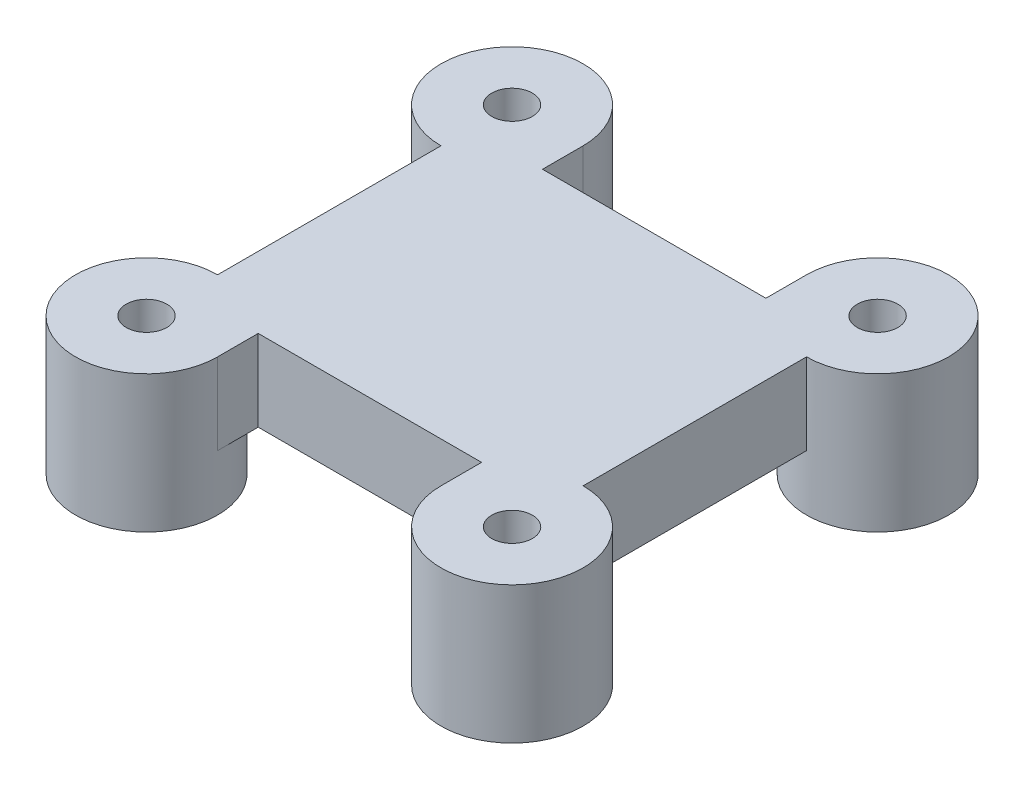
SolidWorks part; units mm, degrees
ref_plane "Front Plane" through (0, 0, 0) normal (0, 0, 1) x (1, 0, 0)
ref_plane "Top Plane" through (0, 0, 0) normal (0, 1, 0) x (1, 0, 0)
ref_plane "Right Plane" through (0, 0, 0) normal (1, 0, 0) x (0, 0, -1)
sketch "Sketch1" plane through (0, 0, 0) normal (0, 1, 0) x (1, 0, 0)
  line L1 (-11, -14) -> (11, -14)
  line L2 (-11, -14) -> (-11, 14)
  line L3 (-11, 14) -> (11, 14)
  line L4 (11, -14) -> (11, 14)
  line L5 (-11, -14) -> (11, 14) construction
  line L6 (-11, 14) -> (11, -14) construction
  line L7 (-11, 18) -> (-18, 18)
  line L8 (-11, 18) -> (-11, -18)
  line L9 (-11, -18) -> (-18, -18)
  line L10 (-18, 18) -> (-18, -18)
  line L11 (11, 18) -> (18, 18)
  line L12 (11, 18) -> (11, -18)
  line L13 (11, -18) -> (18, -18)
  line L14 (18, 18) -> (18, -18)
  circle A0 centre (-18, 18) radius 7
  circle A1 centre (18, 18) radius 7
  circle A2 centre (-18, -18) radius 7
  circle A3 centre (18, -18) radius 7
  point P0 (0, 0)
  dimension "D1" = 22
  dimension "D2" = 28
  dimension "D3" = 4
  dimension "D4" = 4
  dimension "D5" = 7
extrude "Boss-Extrude1" add sketch "Sketch1" along normal blind 8 contours L7 A0 L10 | L10 A0 L7 | A2 L8 L2 A0 L10 | L9 A2 L10 | L10 A2 L9 | L1 L4 L3 L2 | L14 A3 L13 | A3 L14 A1 L12 L4 | L11 A1 L14 | L14 A1 L11 | L13 A3 L14
sketch "Sketch2" plane through (0, 8, 0) normal (0, 1, 0) x (1, 0, 0)
  circle A0 centre (-18, 18) radius 2
  circle A1 centre (-18, -18) radius 2
  circle A2 centre (18, -18) radius 2
  circle A3 centre (18, 18) radius 2
  dimension "D1" = 4
extrude "Cut-Extrude1" cut sketch "Sketch2" against normal through all
sketch "Sketch5" plane through (0, 0, 0) normal (0, -1, 0) x (1, 0, 0)
  circle A0 centre (-18, 18) radius 2
  circle A1 centre (-18, 18) radius 7
  circle A2 centre (18, 18) radius 2
  circle A3 centre (18, 18) radius 7
  circle A4 centre (18, -18) radius 2
  circle A5 centre (18, -18) radius 7
  circle A6 centre (-18, -18) radius 2
  circle A7 centre (-18, -18) radius 7
extrude "Boss-Extrude3" add sketch "Sketch5" along normal blind 5.5
